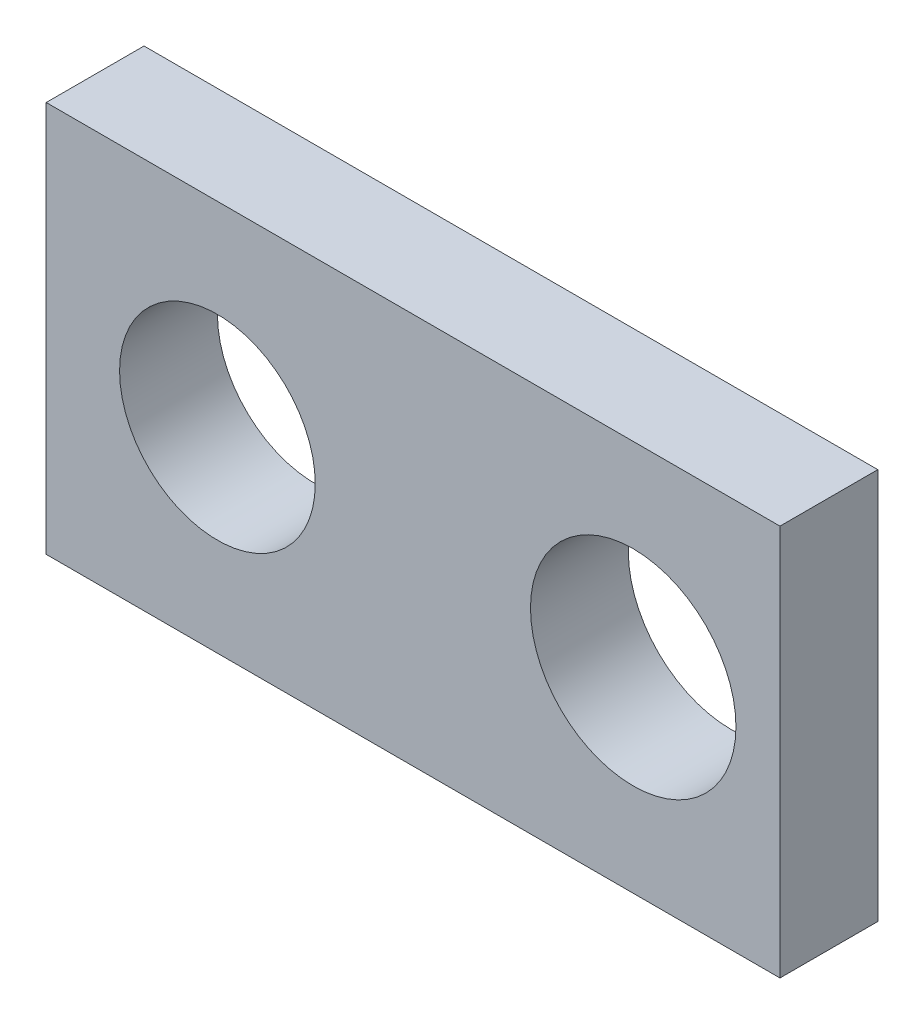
SolidWorks part; units mm, degrees
ref_plane "Face" through (0, 0, 0) normal (0, 0, 1) x (1, 0, 0)
ref_plane "Dessus" through (0, 0, 0) normal (0, 1, 0) x (1, 0, 0)
ref_plane "Droite" through (0, 0, 0) normal (1, 0, 0) x (0, 0, -1)
sketch "Esquisse1" plane through (0, 0, 0) normal (0, 0, 1) x (1, 0, 0)
  line L0 (0, 0) -> (150, 0)
  line L1 (0, 0) -> (0, 80)
  line L2 (150, 0) -> (150, 80)
  line L3 (0, 80) -> (150, 80)
  dimension "D1" = 150
  dimension "D2" = 80
extrude "Base-Extrusion" add sketch "Esquisse1" along normal blind 20
sketch "Esquisse2" plane through (0, 0, 20) normal (0, 0, 1) x (1, 0, 0)
  line L0 (150, 40) -> (7.3131, 40) construction
  line L1 (150, 0) -> (150, 80) construction
  line L2 (0, 80) -> (0, 0) construction
  circle A0 centre (120, 40) radius 21
  circle A1 centre (35, 40) radius 20
  dimension "D1" = 42
  dimension "D2" = 35
  dimension "D3" = 40
  dimension "D4" = 85
extrude "Enlèv. mat.-Extru.1" cut sketch "Esquisse2" against normal through all
